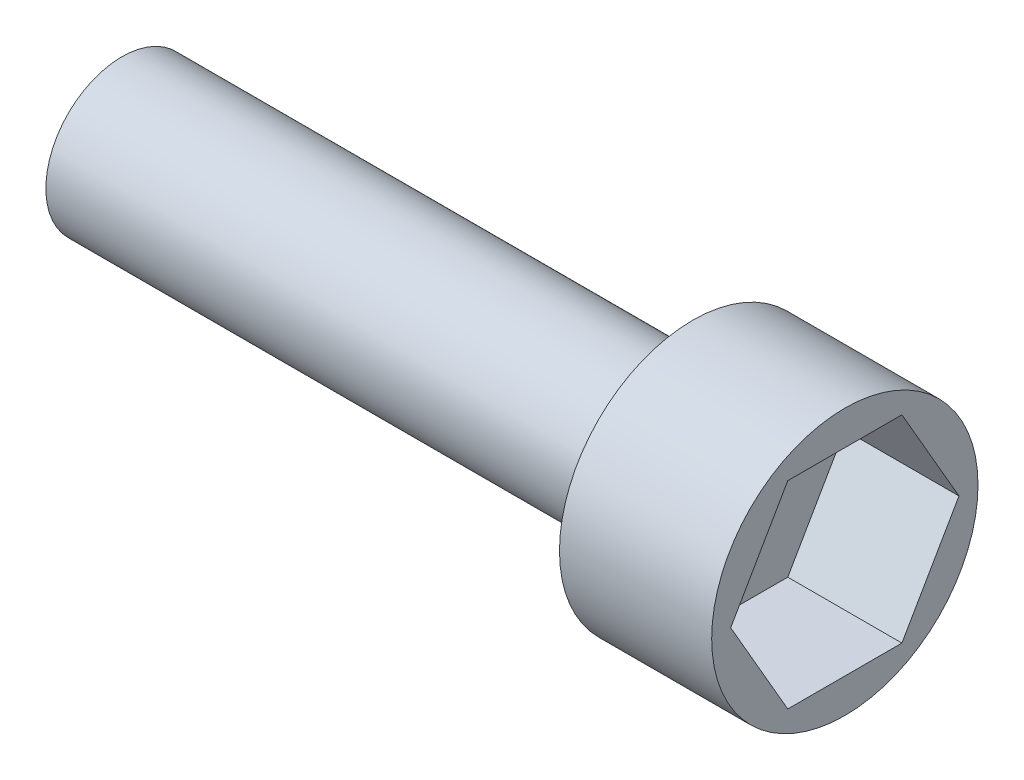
SolidWorks part; units mm, degrees
ref_plane "Front Plane" through (0, 0, 0) normal (0, 0, 1) x (1, 0, 0)
ref_plane "Top Plane" through (0, 0, 0) normal (0, 1, 0) x (1, 0, 0)
ref_plane "Right Plane" through (0, 0, 0) normal (1, 0, 0) x (0, 0, -1)
sketch "Sketch1" plane through (0, 0, 0) normal (1, 0, 0) x (0, 0, -1)
  circle A0 centre (0, 0) radius 2
  dimension "D1" = 4
extrude "Boss-Extrude1" add sketch "Sketch1" along normal blind 15
sketch "Sketch2" plane through (15, 0, 0) normal (1, 0, 0) x (0, 0, -1)
  circle A0 centre (0, 0) radius 3.5
  dimension "D1" = 7
extrude "Boss-Extrude2" add sketch "Sketch2" along normal blind 4
sketch "Sketch3" plane through (19, 0, 0) normal (1, 0, 0) x (0, 0, -1)
  line L1 (-3, 0) -> (-1.5, -2.5981)
  line L2 (-1.5, -2.5981) -> (1.5, -2.5981)
  line L3 (1.5, -2.5981) -> (3, 0)
  line L4 (3, 0) -> (1.5, 2.5981)
  line L5 (1.5, 2.5981) -> (-1.5, 2.5981)
  line L6 (-1.5, 2.5981) -> (-3, 0)
  circle A0 centre (0, 0) radius 2.5981 construction
  dimension "D1" = 3
extrude "Cut-Extrude1" cut sketch "Sketch3" against normal blind 3
